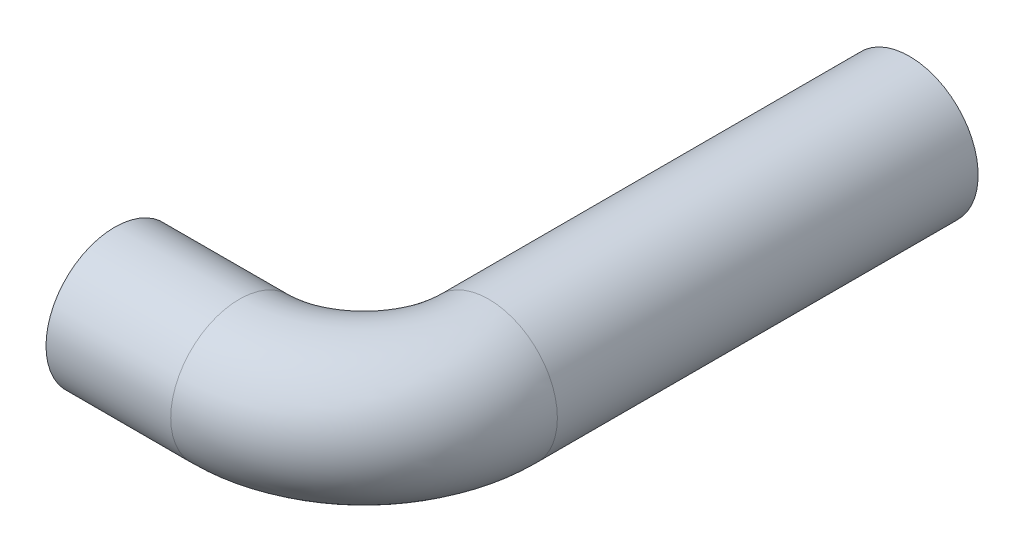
SolidWorks part; units mm, degrees
ref_plane "Front Plane" through (0, 0, 0) normal (0, 0, 1) x (1, 0, 0)
ref_plane "Top Plane" through (0, 0, 0) normal (0, 1, 0) x (1, 0, 0)
ref_plane "Right Plane" through (0, 0, 0) normal (1, 0, 0) x (0, 0, -1)
sketch "Sketch1" plane through (0, 0, 0) normal (1, 0, 0) x (0, 0, -1)
  circle A0 centre (0, 0) radius 1.65
  dimension "D1" = 3.3
sketch "Sketch2" plane through (0, 0, 0) normal (0, 1, 0) x (1, 0, 0)
  line L0 (0, 0) -> (3, 0)
  line L1 (6, 3) -> (6, 13.12)
  line L2 (0, -1.65) -> (0, 1.65) construction
  arc A0 (3, 0) -> (6, 3) centre (3, 3) ccw
  dimension "D3" = 13.12
  dimension "D2" = 3
  dimension "D1" = 6
ref_plane "Plane1" through (6.55, 0, 0) normal (1, 0, 0) x (0, 0, -1)
sweep "Sweep1" add profiles "Sketch1" path "Sketch2"
